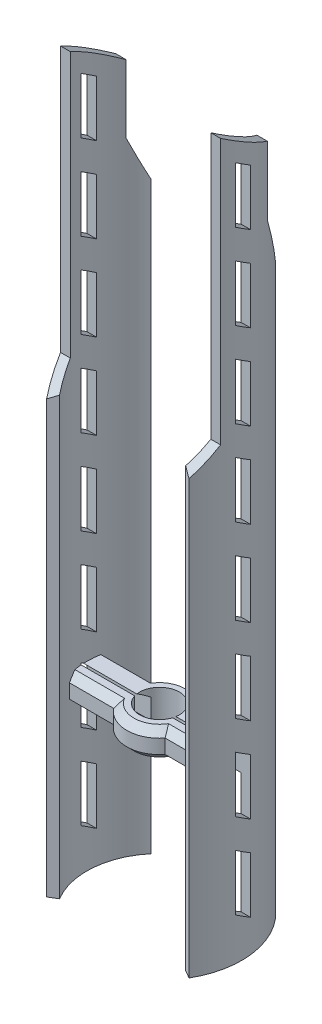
SolidWorks part; units mm, degrees
ref_plane "Front Plane" through (0, 0, 0) normal (0, 0, 1) x (1, 0, 0)
ref_plane "Top Plane" through (0, 0, 0) normal (0, 1, 0) x (1, 0, 0)
ref_plane "Right Plane" through (0, 0, 0) normal (1, 0, 0) x (0, 0, -1)
sketch "Sketch1" plane through (0, 0, 0) normal (0, 1, 0) x (1, 0, 0)
  line L0 (9.0659, -7.0753) -> (27.1557, -7.0753)
  line L1 (-27.1557, 7.0753) -> (-9.0659, 7.0753)
  line L2 (-27.1557, 7.0753) -> (-27.1557, -7.0753)
  line L3 (-27.1557, -7.0753) -> (-9.0659, -7.0753)
  line L4 (27.1557, 7.0753) -> (27.1557, -7.0753)
  line L7 (9.0659, 7.0753) -> (27.1557, 7.0753)
  circle A0 centre (0, 0) radius 7
  arc A1 (-9.0659, -7.0753) -> (9.0659, -7.0753) centre (0, 0) ccw
  arc A2 (9.0659, 7.0753) -> (-9.0659, 7.0753) centre (0, 0) ccw
extrude "Boss-Extrude1" add sketch "Sketch1" along normal blind 10
chamfer "Chamfer1" distance 2.5 angle 45 12 edges at (0, 10, -11.5) (0, 10, 11.5) (0, 0, -11.5) (0, 0, 11.5) (-18.1108, 10, -7.0753) (18.1108, 10, -7.0753) (-18.1108, 10, 7.0753) (18.1108, 10, 7.0753) (-18.1108, 0, -7.0753) (18.1108, 0, -7.0753) (-18.1108, 0, 7.0753) (18.1108, 0, 7.0753)
sketch "Sketch2" plane through (0, 0, 0) normal (0, -1, 0) x (1, 0, 0)
  line L0 (-19.6202, -16.5581) -> (-22.1624, -18.7037)
  line L1 (22.1624, 12.9595) -> (25.0341, 14.6388)
  line L2 (22.1624, -18.7037) -> (19.6202, -16.5581)
  line L3 (-24.8117, 15.0126) -> (-21.9656, 13.2905)
  arc A0 (22.1624, -18.7037) -> (25.0341, 14.6388) centre (0, 0) ccw
  arc A1 (19.6202, -16.5581) -> (22.1624, 12.9595) centre (0, 0) ccw
  arc A2 (-24.8117, 15.0126) -> (-22.1624, -18.7037) centre (0, 0) ccw
  arc A3 (-21.9656, 13.2905) -> (-19.6202, -16.5581) centre (0, 0) ccw
extrude "Boss-Extrude2" add sketch "Sketch2" along normal blind 54 and the other way blind 200
ref_plane "Plane1" through (24.6792, 0, 0) normal (1, 0, 0) x (0, 0, -1)
ref_plane "Plane2" through (34.6792, 0, 0) normal (1, 0, 0) x (0, 0, -1)
sketch "Sketch3" plane through (34.6792, 0, 0) normal (1, 0, 0) x (0, 0, -1)
  line L0 (-6.6869, 200) -> (-6.6869, 106.4216)
  line L1 (18.7037, 200) -> (-14.6388, 200) construction
  line L2 (-6.6869, 106.4216) -> (-27.9488, 85.1597)
  line L3 (-27.9488, 85.1597) -> (-27.9488, 200)
  line L4 (-27.9488, 200) -> (-6.6869, 200)
  line L5 (11.2911, 200) -> (11.2911, 165.4351)
  line L6 (11.2911, 165.4351) -> (28.3326, 122.3579)
  line L7 (28.3326, 122.3579) -> (28.3326, 200)
  line L8 (28.3326, 200) -> (11.2911, 200)
extrude "Cut-Extrude1" cut sketch "Sketch3" against normal blind 147
sketch "Sketch4" plane through (34.6792, 0, 0) normal (1, 0, 0) x (0, 0, -1)
  line L0 (-6.6869, 200) -> (11.2911, 189.4243)
  line L1 (11.2911, 200) -> (11.2911, 165.4351) construction
  line L2 (11.2911, 189.4243) -> (11.2911, 206.9507)
  line L3 (11.2911, 206.9507) -> (-6.6869, 206.9507)
  line L4 (-6.6869, 206.9507) -> (-6.6869, 200)
extrude "Cut-Extrude2" cut sketch "Sketch4" against normal blind 147
sketch "Sketch5" plane through (34.6792, 0, 0) normal (1, 0, 0) x (0, 0, -1)
  line L0 (-2.05, 190.6028) -> (3.2554, 187.1922)
  line L1 (3.2554, 187.1922) -> (3.2554, 167.4865)
  line L2 (3.2554, 167.4865) -> (-2.05, 170.8971)
  line L3 (-2.05, 170.8971) -> (-2.05, 190.6028)
  line L4 (-2.05, 170.8971) -> (-2.05, -53.1666)
  line L5 (-2.05, 190.6028) -> (23.5971, 190.6028)
extrude "Cut-Extrude3" cut sketch "Sketch5" against normal blind 263 contours L3 L2 L1 L0
pattern_linear "LPattern1" count 8 spacing 30 along (0, -1, 0) of "Cut-Extrude3"
